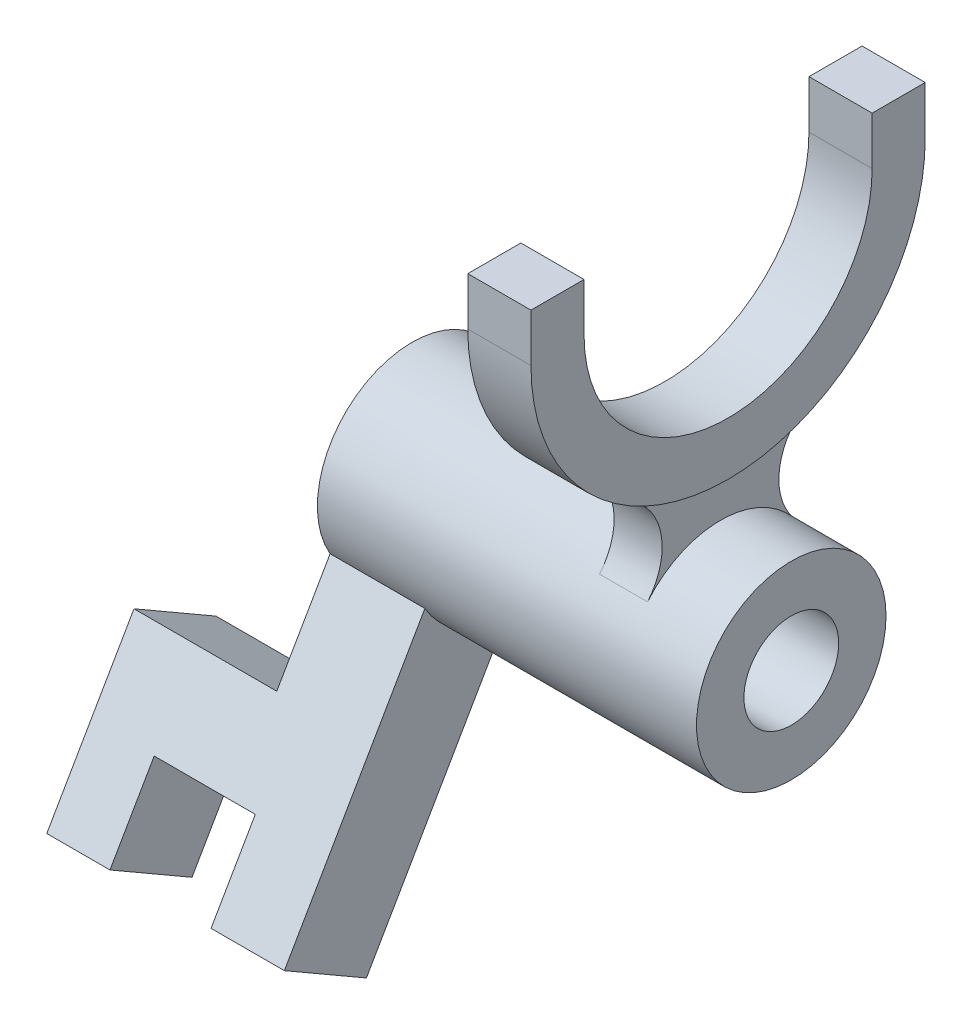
SolidWorks part; units mm, degrees
ref_plane "Front Plane" through (0, 0, 0) normal (0, 0, 1) x (1, 0, 0)
ref_plane "Top Plane" through (0, 0, 0) normal (0, 1, 0) x (1, 0, 0)
ref_plane "Right Plane" through (0, 0, 0) normal (1, 0, 0) x (0, 0, -1)
sketch "Sketch1" plane through (0, 0, 0) normal (1, 0, 0) x (0, 0, -1)
  circle A0 centre (0, 0) radius 19.05
  circle A1 centre (0, 0) radius 9.525
  dimension "D1" = 19.05
  dimension "D2" = 38.1
extrude "Extrude1" add sketch "Sketch1" along normal blind 19.05 and the other way blind 57.15
sketch "Sketch2" plane through (0, 0, 0) normal (1, 0, 0) x (0, 0, -1)
  line L0 (0, 0) -> (0, 66.548) construction
  line L1 (-39.624, 66.548) -> (-39.624, 76.2)
  line L2 (39.624, 66.548) -> (39.624, 76.2)
  arc A0 (-39.624, 66.548) -> (39.624, 66.548) centre (0, 66.548) ccw
  dimension "D2" = 39.624
  dimension "D1" = 66.548
  dimension "D3" = 9.652
extrude "Extrude-Thin1" add sketch "Sketch2" along normal mid plane 12.7 thin
sketch "Sketch4" plane through (0, 0, 0) normal (1, 0, 0) x (0, 0, -1)
  circle A0 centre (0, 0) radius 19.05 construction
  arc A1 (14.6586, 12.1667) -> (-14.6586, 12.1667) centre (0, 0) ccw
  arc A2 (-39.624, 66.548) -> (39.624, 66.548) centre (0, 66.548) ccw construction
  arc A3 (-18.5011, 31.5085) -> (18.5011, 31.5085) centre (0, 66.548) ccw
  arc A4 (-18.5011, 31.5085) -> (-14.6586, 12.1667) centre (-24.431, 20.2778) cw
  arc A5 (18.5011, 31.5085) -> (14.6586, 12.1667) centre (24.431, 20.2778) ccw
  dimension "D1" = 12.7
extrude "Extrude2" add sketch "Sketch4" along normal mid plane 9.652
ref_plane "Plane1" through (0, 0, 0) normal (0, 0.5, 0.866) x (1, 0, 0)
sketch "Sketch5" plane through (0, 0, 0) normal (0, 0.5, 0.866) x (1, 0, 0)
  line L0 (-57.15, -9.525) -> (-57.15, -37.9406)
  line L2 (-57.15, -37.9406) -> (-85.852, -37.9406)
  line L3 (-85.852, -37.9406) -> (-85.852, -72.9926)
  line L4 (-85.852, -72.9926) -> (-73.152, -72.9926)
  line L5 (-73.152, -72.9926) -> (-73.152, -55.2126)
  line L6 (-73.152, -55.2126) -> (-52.832, -55.2126)
  line L7 (-52.832, -55.2126) -> (-52.832, -72.9926)
  line L8 (-52.832, -72.9926) -> (-38.1, -72.9926)
  line L9 (-38.1, -72.9926) -> (-38.1, -9.525)
  line L10 (-38.1, -9.525) -> (-57.15, -9.525)
  line L11 (-57.15, -9.525) -> (19.05, -9.525) construction
  dimension "D1" = 17.78
  dimension "D2" = 12.7
  dimension "D3" = 35.052
  dimension "D4" = 41.148
  dimension "D5" = 19.05
  dimension "D6" = 47.752
  dimension "D7" = 20.32
extrude "Extrude3" add sketch "Sketch5" along normal mid plane 19.05
